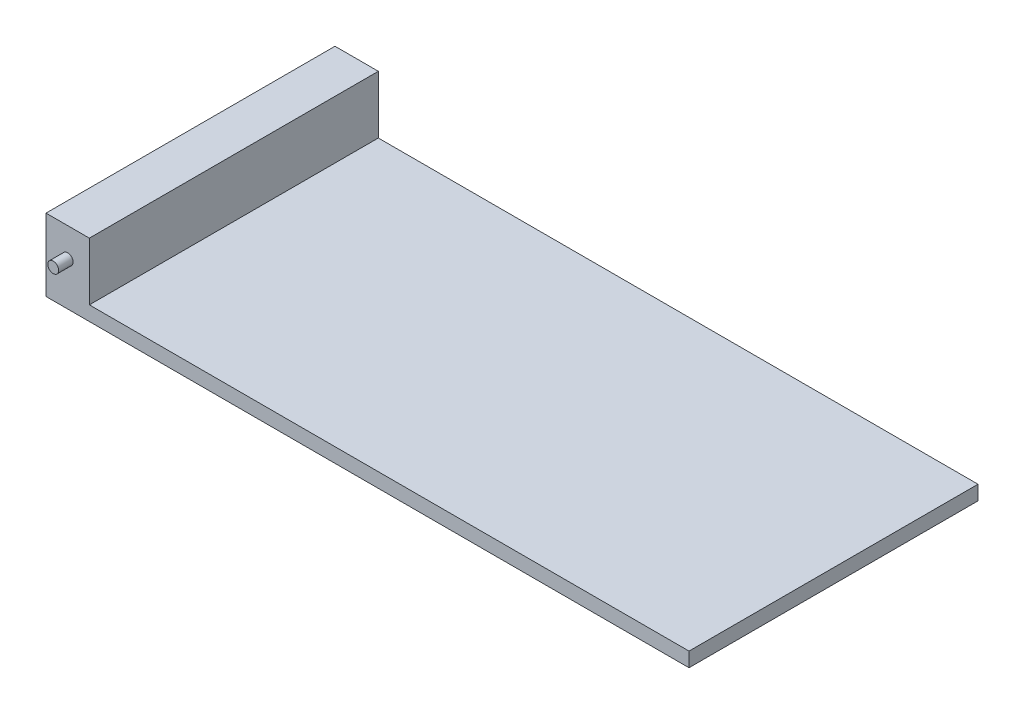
SolidWorks part; units mm, degrees
ref_plane "Front Plane" through (0, 0, 0) normal (0, 0, 1) x (1, 0, 0)
ref_plane "Top Plane" through (0, 0, 0) normal (0, 1, 0) x (1, 0, 0)
ref_plane "Right Plane" through (0, 0, 0) normal (1, 0, 0) x (0, 0, -1)
sketch "Sketch1" plane through (0, 0, 0) normal (0, 0, 1) x (1, 0, 0)
  line L1 (0, 0) -> (565.15, 0)
  line L2 (0, 0) -> (0, 12.7)
  line L3 (0, 12.7) -> (565.15, 12.7)
  line L4 (565.15, 0) -> (565.15, 12.7)
  dimension "D1" = 565.15
  dimension "D2" = 12.7
extrude "Extrude1" add sketch "Sketch1" along normal blind 254
sketch "Sketch7" plane through (0, 12.7, 0) normal (0, 1, 0) x (-1, 0, 0)
  line L1 (-565.15, 0) -> (0, 0) construction
  line L2 (0, 254) -> (-38.1, 254)
  line L3 (0, 254) -> (0, 0)
  line L4 (0, 0) -> (-38.1, 0)
  line L5 (-38.1, 254) -> (-38.1, 0)
  dimension "D1" = 38.1
extrude "Extrude4" add sketch "Sketch7" along normal blind 50.8
sketch "Sketch8" plane through (0, 0, 254) normal (0, 0, 1) x (1, 0, 0)
  line L11 (0, 63.5) -> (0, 0) construction
  line L16 (0, 63.5) -> (38.1, 63.5) construction
  circle A0 centre (19.05, 38.1) radius 4.7625
  dimension "D1" = 9.525
  dimension "D2" = 19.05
  dimension "D3" = 25.4
extrude "Boss-Extrude1" add sketch "Sketch8" along normal blind 12.7
ref_plane "Plane1" through (0, 0, 127) normal (0, 0, 1) x (1, 0, 0)
mirror "Mirror1" about plane through (0, 0, 127) normal (0, 0, 1) of "Boss-Extrude1"
sketch "Sketch9" [suppressed] plane through (38.1, 0, 0) normal (1, 0, 0) x (0, 0, -1)
  line L0 (-127, 63.5) -> (-127, 12.7) construction
  line L1 (-254, 63.5) -> (0, 63.5) construction
  line L2 (-254, 12.7) -> (0, 12.7) construction
  line L3 (-254, 38.1) -> (0, 38.1) construction
  line L4 (0, 63.5) -> (0, 12.7) construction
  line L5 (-254, 12.7) -> (0, 12.7) construction
  line L7 (-184.15, 25.4) -> (-171.45, 25.4)
  line L8 (-184.15, 25.4) -> (-184.15, 50.8)
  line L9 (-184.15, 50.8) -> (-171.45, 50.8)
  line L10 (-171.45, 25.4) -> (-171.45, 50.8)
  line L11 (-184.15, 25.4) -> (-171.45, 50.8) construction
  line L12 (-184.15, 50.8) -> (-171.45, 25.4) construction
  point P11 (-127, 38.1)
  point P13 (-177.8, 38.1)
  dimension "D1" = 25.4
  dimension "D2" = 50.8
  dimension "D3" = 25.4
  dimension "D4" = 12.7
extrude "Boss-Extrude2" [suppressed] add sketch "Sketch9" along normal blind 25.4
sketch "Sketch10" [suppressed] plane through (0, 0, 184.15) normal (0, 0, 1) x (1, 0, 0)
  line L0 (50.8, 50.8) -> (50.8, 25.4) construction
  line L1 (63.5, 50.8) -> (38.1, 50.8) construction
  line L2 (63.5, 25.4) -> (38.1, 25.4) construction
  circle A0 centre (50.8, 38.1) radius 6.35
  point P9 (50.8, 38.1)
  dimension "D1" = 12.7
extrude "Cut-Extrude1" [suppressed] cut sketch "Sketch10" against normal through all contours A0
mirror "Mirror2" [suppressed] about plane through (0, 0, 127) normal (0, 0, 1)
